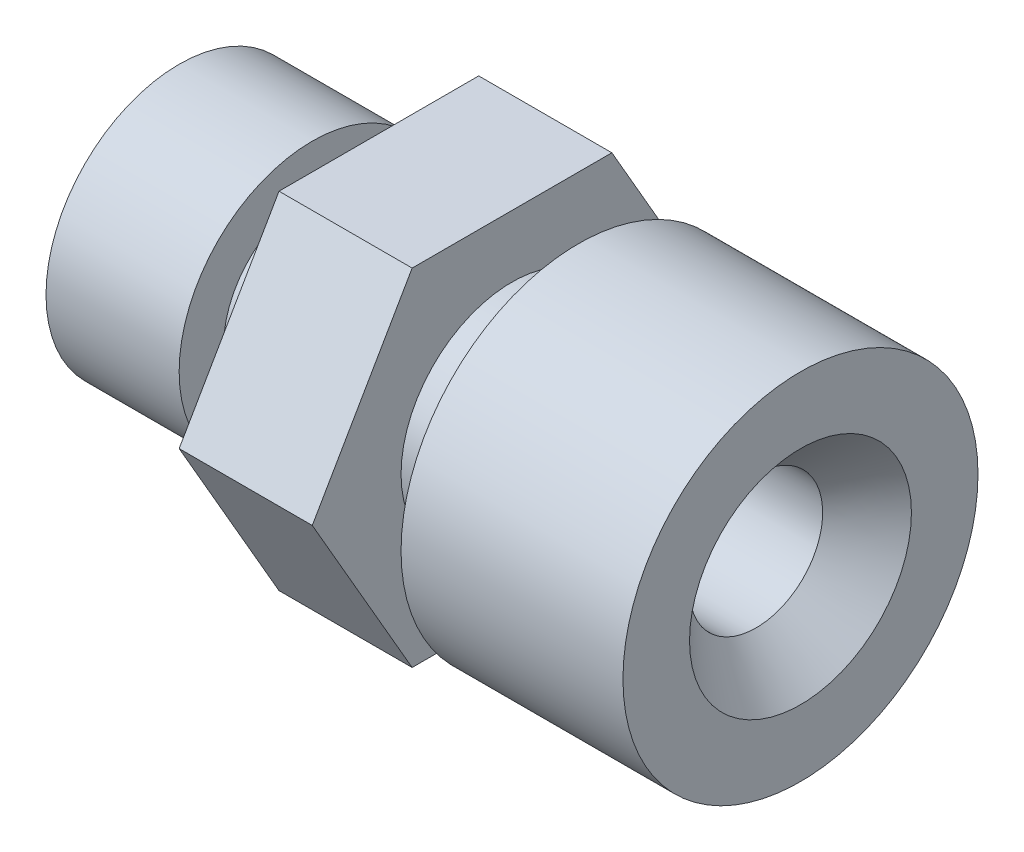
SolidWorks part; units mm, degrees
ref_plane "前视" through (0, 0, 0) normal (0, 0, 1) x (1, 0, 0)
ref_plane "上视" through (0, 0, 0) normal (0, 1, 0) x (1, 0, 0)
ref_plane "右视" through (0, 0, 0) normal (1, 0, 0) x (0, 0, -1)
sketch "草图1" plane through (0, 0, 0) normal (0, 0, 1) x (1, 0, 0)
  line L0 (0, 0) -> (100.4269, 0) construction
  line L1 (0, 3) -> (0, 6)
  line L2 (0, 6) -> (6, 6)
  line L3 (6, 6) -> (6, 4)
  line L4 (6, 4) -> (9, 4)
  line L5 (9, 4) -> (9, 9)
  line L6 (9, 9) -> (15, 9)
  line L7 (15, 9) -> (15, 5)
  line L8 (15, 5) -> (18, 5)
  line L9 (18, 5) -> (18, 8)
  line L10 (18, 8) -> (28, 8)
  line L11 (28, 8) -> (28, 3)
  line L12 (28, 3) -> (0, 3)
  dimension "D1" = 6
  dimension "D2" = 12
  dimension "D3" = 8
  dimension "D4" = 18
  dimension "D5" = 10
  dimension "D6" = 16
  dimension "D7" = 6
  dimension "D8" = 3
  dimension "D9" = 6
  dimension "D10" = 3
  dimension "D11" = 28
revolve "旋转1" add sketch "草图1" angle 360 about L0
sketch "草图2" plane through (15, 0, 0) normal (1, 0, 0) x (0, 0, -1)
  line L1 (4.5, 7.7942) -> (-4.5, 7.7942)
  line L2 (-4.5, 7.7942) -> (-9, 0)
  line L3 (-9, 0) -> (-4.5, -7.7942)
  line L4 (-4.5, -7.7942) -> (4.5, -7.7942)
  line L5 (4.5, -7.7942) -> (9, 0)
  line L6 (9, 0) -> (4.5, 7.7942)
  circle A0 centre (0, 0) radius 9 construction
  circle A1 centre (0, 0) radius 9 construction
  circle A2 centre (0, 0) radius 9 construction
  circle A3 centre (0, 0) radius 11.4197
extrude "切除-拉伸2" cut sketch "草图2" against normal up to surface (6 mm away)
chamfer "倒角1" distance 2 angle 45
